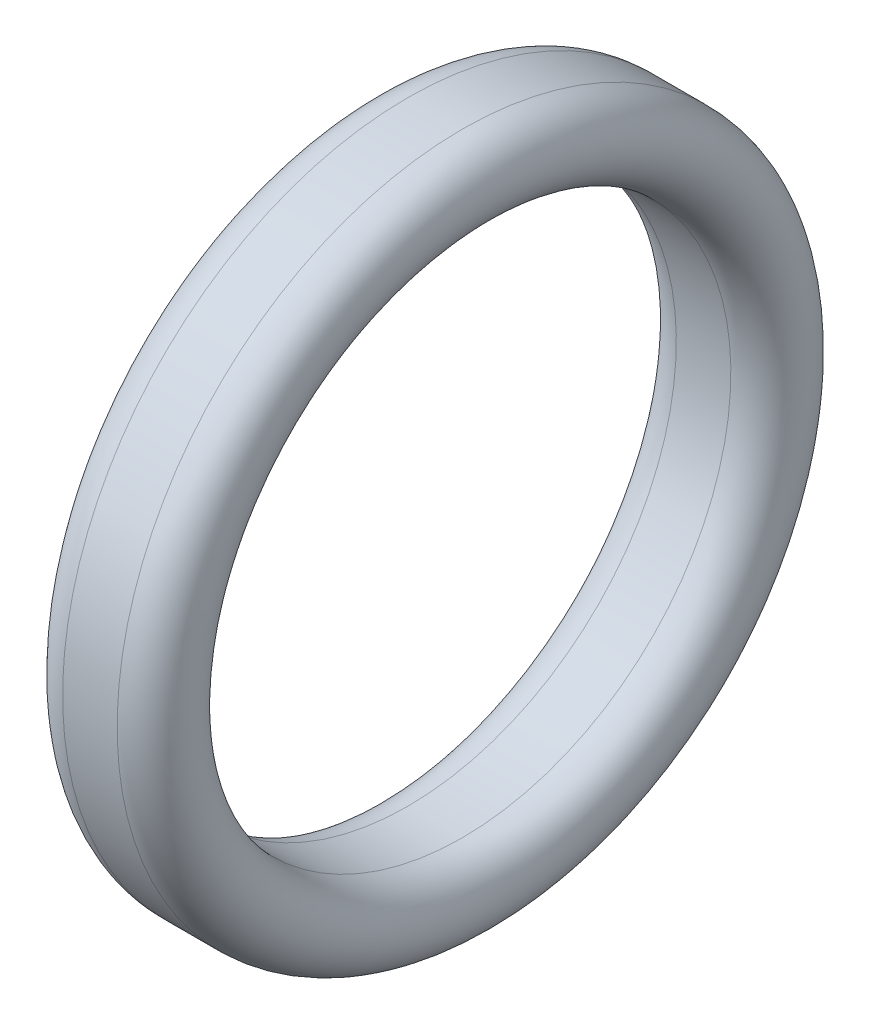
SolidWorks part; units mm, degrees
ref_plane "Front" through (0, 0, 0) normal (0, 0, 1) x (1, 0, 0)
ref_plane "Top" through (0, 0, 0) normal (0, 1, 0) x (1, 0, 0)
ref_plane "Right" through (0, 0, 0) normal (1, 0, 0) x (0, 0, -1)
sketch "Sketch2" plane through (0, 0, 0) normal (0, 0, 1) x (1, 0, 0)
  line L1 (-75, 0) -> (75, 0) construction
  line L5 (-54.7903, 12.7) -> (-52.7837, 12.7)
  line L6 (-54.7903, 9.8806) -> (-52.7837, 9.8806)
  line L16 (-48.1, 11.7516) -> (-48.1, -11.7516) construction
  arc A0 (-52.7837, 9.8806) -> (-52.7837, 12.7) centre (-52.7837, 11.2903) ccw
  arc A1 (-54.7903, 12.7) -> (-54.7903, 9.8806) centre (-54.7903, 11.2903) ccw
  point P1 (0, 0)
  point P32 (-48.1, 0)
  dimension "D3" = 4.826
  dimension "D4" = 52.7837
  dimension "D1" = 48.1
  dimension "D2" = 2.8194
  dimension "D6" = 9.8806
revolve "Base-Revolve" add sketch "Sketch2" angle 360 about L1
